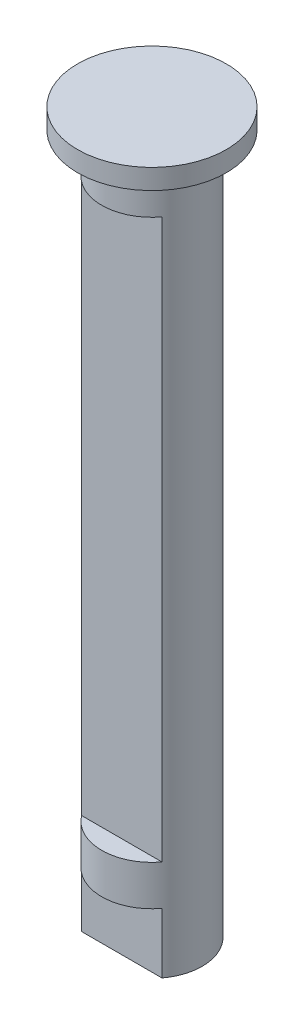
SolidWorks part; units mm, degrees
ref_plane "前视基准面" through (0, 0, 0) normal (0, 0, 1) x (1, 0, 0)
ref_plane "上视基准面" through (0, 0, 0) normal (0, 1, 0) x (1, 0, 0)
ref_plane "右视基准面" through (0, 0, 0) normal (1, 0, 0) x (0, 0, -1)
other "Configuration Table"
sketch "草图1" plane through (0, 0, 0) normal (0, 1, 0) x (1, 0, 0)
  line L0 (-2, -1.5) -> (2, -1.5)
  arc A0 (2, -1.5) -> (-2, -1.5) centre (0, 0) ccw
  dimension "D1" = 1.5
  dimension "D2" = 2.5
extrude "凸台-拉伸1" add sketch "草图1" along normal blind 27.8
sketch "草图2" plane through (0, 27.8, 0) normal (0, 1, 0) x (1, 0, 0)
  circle A0 centre (0, 0) radius 2.5
extrude "凸台-拉伸2" add sketch "草图2" along normal blind 2
sketch "草图3" plane through (0, 29.8, 0) normal (0, 1, 0) x (1, 0, 0)
  circle A0 centre (0, 0) radius 3.7
extrude "凸台-拉伸3" add sketch "草图3" along normal blind 1
sketch "草图4" plane through (0, 0, 0) normal (0, -1, 0) x (1, 0, 0)
  circle A0 centre (0, 0) radius 2.5
extrude "凸台-拉伸4" add sketch "草图4" along normal blind 2
sketch "草图5" plane through (0, -2, 0) normal (0, -1, 0) x (1, 0, 0)
  line L0 (-2, 1.5) -> (2, 1.5)
  arc A0 (-2, 1.5) -> (2, 1.5) centre (0, 0) ccw
  dimension "D1" = 1.5
extrude "凸台-拉伸5" add sketch "草图5" along normal blind 3
